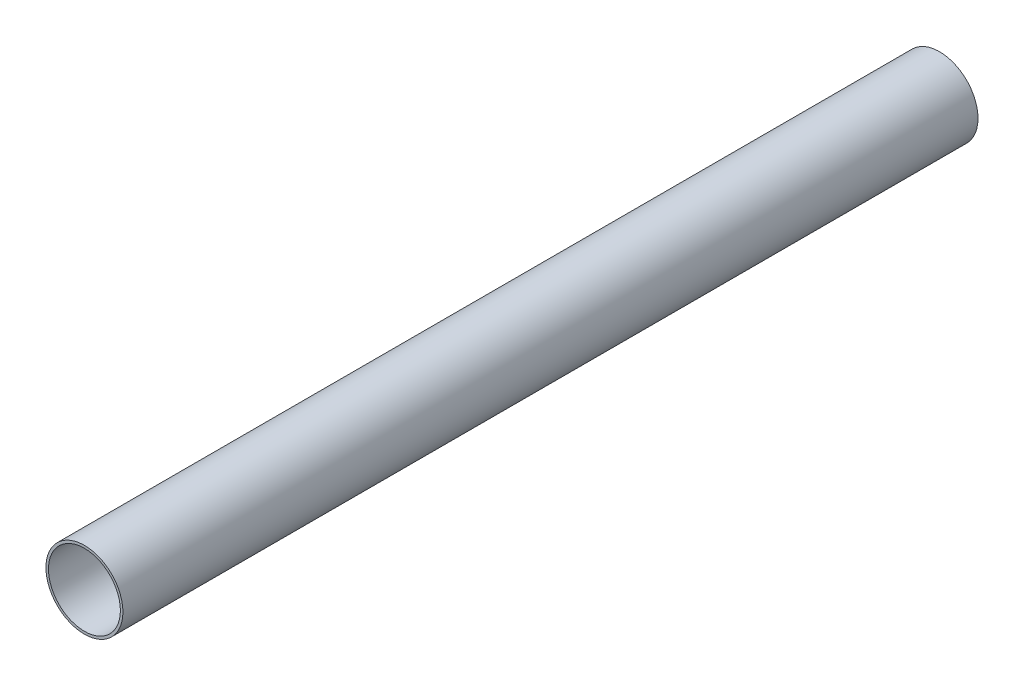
SolidWorks part; units mm, degrees
ref_plane "Front" through (0, 0, 0) normal (0, 0, 1) x (1, 0, 0)
ref_plane "Top" through (0, 0, 0) normal (0, 1, 0) x (1, 0, 0)
ref_plane "Right" through (0, 0, 0) normal (1, 0, 0) x (0, 0, -1)
sketch "Sketch1" plane through (0, 0, 0) normal (0, 0, 1) x (1, 0, 0)
  circle A0 centre (0, 0) radius 26.9875
  circle A1 centre (0, 0) radius 25.2095
  dimension "D1" = 53.975
  dimension "D2" = 50.419
extrude "Boss-Extrude1" add sketch "Sketch1" along normal blind 599.44
